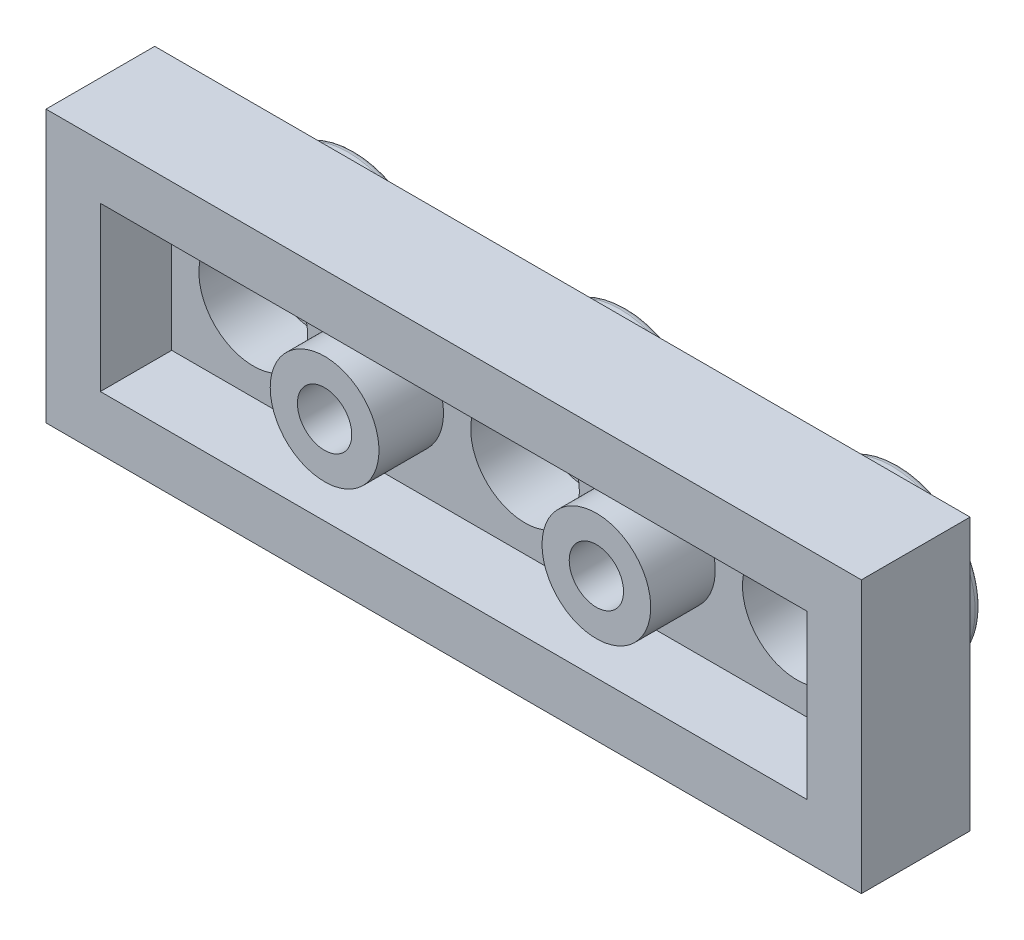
SolidWorks part; units mm, degrees
ref_plane "Vorne" through (0, 0, 0) normal (0, 0, 1) x (1, 0, 0)
ref_plane "Oben" through (0, 0, 0) normal (0, 1, 0) x (1, 0, 0)
ref_plane "Rechts" through (0, 0, 0) normal (1, 0, 0) x (0, 0, -1)
sketch "Skizze1" plane through (0, 0, 0) normal (0, 0, 1) x (1, 0, 0)
  line L1 (0, 0) -> (-24, 0)
  line L2 (0, 0) -> (0, -8)
  line L3 (0, -8) -> (-24, -8)
  line L4 (-24, 0) -> (-24, -8)
  dimension "D1" = 24
  dimension "D2" = 8
extrude "Linear austragen1" add sketch "Skizze1" along normal blind 3.2
sketch "Skizze2" plane through (0, 0, 3.2) normal (0, 0, 1) x (1, 0, 0)
  line L0 (-24, -8) -> (0, -8) construction
  line L1 (-1.6, -6.4) -> (-22.4, -6.4)
  line L2 (-1.6, -6.4) -> (-1.6, -1.6)
  line L3 (-1.6, -1.6) -> (-22.4, -1.6)
  line L4 (-22.4, -6.4) -> (-22.4, -1.6)
  line L5 (0, -8) -> (0, 0) construction
  line L6 (0, 0) -> (-24, 0) construction
  line L7 (-24, 0) -> (-24, -8) construction
  dimension "D1" = 1.6
  dimension "D2" = 1.6
  dimension "D3" = 1.6
  dimension "D4" = 1.6
extrude "Schnitt-Linear austragen1" cut sketch "Skizze2" against normal blind 2.1
sketch "Skizze3" plane through (0, 0, 1.1) normal (0, 0, 1) x (1, 0, 0)
  line L0 (0, -8) -> (0, 0) construction
  line L1 (-24, -8) -> (0, -8) construction
  circle A0 centre (-8, -4) radius 1.6
  circle A1 centre (-8, -4) radius 0.8
  dimension "D1" = 3.2
  dimension "D2" = 1.6
  dimension "D3" = 8
  dimension "D4" = 4
extrude "Linear austragen2" add sketch "Skizze3" along normal blind 1.9
sketch "Skizze4" plane through (0, 0, 0) normal (0, 0, -1) x (-1, 0, 0)
  line L0 (0, 0) -> (24, 0) construction
  line L1 (0, -8) -> (0, 0) construction
  circle A0 centre (4, -4) radius 2.45
  dimension "D1" = 4.9
  dimension "D2" = 4
  dimension "D3" = 4
extrude "Linear austragen3" add sketch "Skizze4" along normal blind 1.9
fillet "Verrundung1" radius 0.2 1 edges at (-6.45, -4, -1.9)
sketch "Skizze9" plane through (0, 0, 1.1) normal (0, 0, 1) x (1, 0, 0)
  circle A0 centre (-4, -4) radius 1.6
extrude "Schnitt-Linear austragen2" cut sketch "Skizze9" against normal blind 1.8
sketch "Skizze8" plane through (0, 0, -1.9) normal (0, 0, -1) x (-1, 0, 0)
  line L0 (4.5102, -5.6382) -> (4.746, -2.1452) construction
  text T0 "Lego  " font "SWIsop1" height in points 5
extrude "Linear austragen4" add sketch "Skizze8" along normal blind 0.2
pattern_linear "Lineares Muster1" count 3 spacing 8 along (-1, 0, 0) of "Verrundung1", "Linear austragen3", "Schnitt-Linear austragen2"
pattern_linear "Lineares Muster2" count 2 spacing 8 along (-1, 0, 0) of "Linear austragen2"
